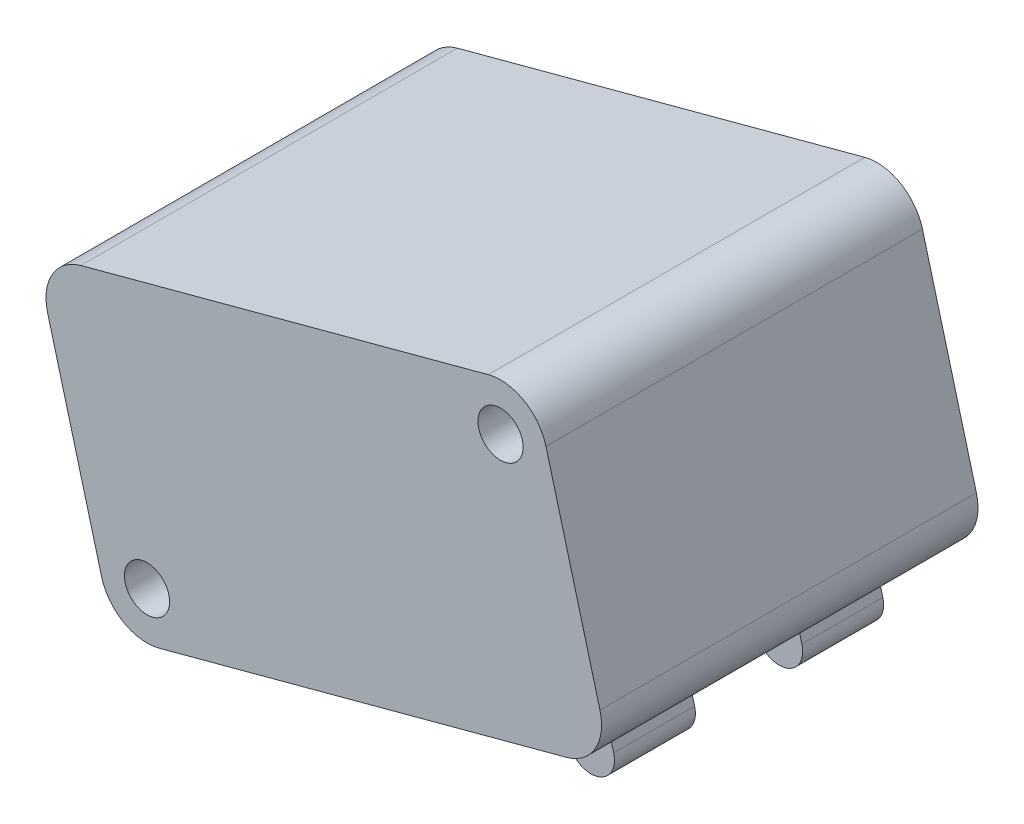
SolidWorks part; units mm, degrees
ref_plane "Plan1" through (0, 0, 0) normal (0, 0, 1) x (1, 0, 0)
ref_plane "Plan2" through (0, 0, 0) normal (0, 1, 0) x (1, 0, 0)
ref_plane "Plan3" through (0, 0, 0) normal (1, 0, 0) x (0, 0, -1)
sketch "Esquisse1" plane through (0, 0, 0) normal (0, 0, 1) x (1, 0, 0)
  line L0 (15.1923, 55.4012) -> (18.0591, 44.7019)
  line L1 (-6.0042, 38.2542) -> (19.7235, 38.2542) construction
  line L2 (-6.0042, 38.2542) -> (15.6684, 44.0613) construction
  line L3 (-11.2859, 48.3064) -> (-8.419, 37.6071)
  line L4 (-5.3571, 35.8394) -> (16.2914, 41.6401)
  line L6 (12.1304, 57.169) -> (-9.5181, 51.3683)
  arc A0 (15.1923, 55.4012) -> (12.1304, 57.169) centre (12.7775, 54.7542) ccw
  arc A1 (-8.419, 37.6071) -> (-5.3571, 35.8394) centre (-6.0042, 38.2542) ccw
  arc A2 (-11.2859, 48.3064) -> (-9.5181, 51.3683) centre (-8.871, 48.9535) cw
  arc A3 (18.0591, 44.7019) -> (16.2914, 41.6401) centre (15.6443, 44.0549) cw
  dimension "D2" = 5
  dimension "D1" = 15
extrude "Base-Extrusion" add sketch "Esquisse1" along normal blind 20
sketch "Esquisse2" plane through (-9.3187, 34.7779, 0) normal (0.2588, -0.9659, 0) x (0.9659, 0.2588, 0)
  line L1 (29.0135, 20) -> (29.0135, 0) construction
  line L2 (23.3135, 17.15) -> (25.8135, 17.15)
  line L3 (23.3135, 17.15) -> (23.3135, 12.85)
  line L4 (23.3135, 12.85) -> (25.8135, 12.85)
  line L6 (25.8135, 17.15) -> (25.8135, 12.85)
  line L7 (4.1013, 20) -> (26.5135, 20) construction
  line L8 (30.9444, 10) -> (-5.8517, 10) construction
  line L10 (23.3135, 7.15) -> (25.8135, 7.15)
  line L11 (25.8135, 2.85) -> (25.8135, 7.15)
  line L12 (23.3135, 2.85) -> (23.3135, 7.15)
  line L13 (23.3135, 2.85) -> (25.8135, 2.85)
  dimension "D1" = 3.2
  dimension "D2" = 2.5
  dimension "D3" = 4.3
  dimension "D4" = 2.85
  dimension "D5" = 10
extrude "Boss.-Extru.1" add sketch "Esquisse2" along normal blind 2.5
fillet "Congé1" radius 1.25
sketch "Esquisse3" plane through (0, 0, 0) normal (0, 0, -1) x (-1, 0, 0)
  circle A0 centre (6.0042, 38.2542) radius 1.2 construction
  circle A1 centre (6.0042, 38.2542) radius 1.2
  circle A2 centre (-12.7775, 54.7542) radius 1.2 construction
  circle A3 centre (-12.7775, 54.7542) radius 1.2
extrude "Enlèv. mat.-Extru.1" cut sketch "Esquisse3" against normal blind 30
